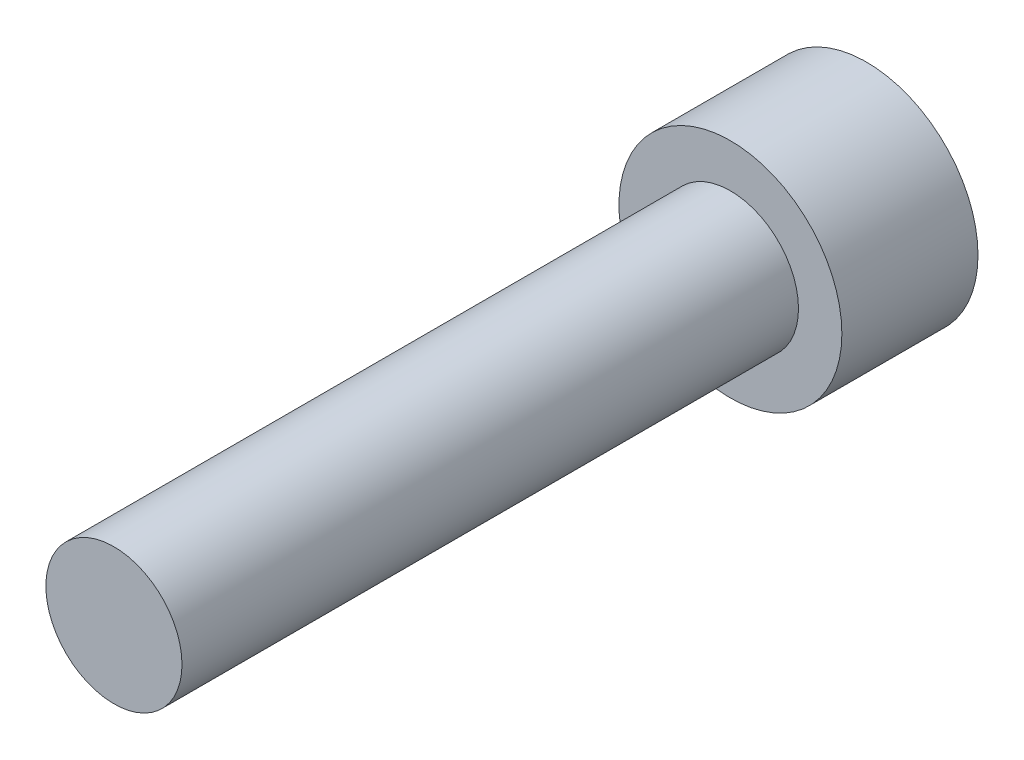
SolidWorks part; units mm, degrees
ref_plane "Front Plane" through (0, 0, 0) normal (0, 0, 1) x (1, 0, 0)
ref_plane "Top Plane" through (0, 0, 0) normal (0, 1, 0) x (1, 0, 0)
ref_plane "Right Plane" through (0, 0, 0) normal (1, 0, 0) x (0, 0, -1)
sketch "Sketch6" plane through (0, 0, 0) normal (1, 0, 0) x (0, 0, -1)
  line L0 (-15.875, 0) -> (22.525, 0) construction
  line L1 (3.1572, 0) -> (-3.1572, 0) construction
  line L2 (-15.875, 0) -> (-15.875, -1.7526)
  line L3 (-15.875, -1.7526) -> (0, -1.7526)
  line L4 (0, 3.1572) -> (0, -3.1572) construction
  line L5 (0, -1.7526) -> (0, -2.8702)
  line L6 (0, -2.8702) -> (3.5052, -2.8702)
  line L7 (3.5052, -2.8702) -> (3.5052, 0)
  line L8 (3.5052, 0) -> (-15.875, 0)
  dimension "L" = 15.875
  dimension "H" = 3.5052
  dimension "A" = 5.7404
  dimension "D" = 3.5052
revolve "Revolve1" add sketch "Sketch6" angle 360 about L0
sketch "Sketch7" plane through (0, 0, -3.5052) normal (0, 0, -1) x (-1, 0, 0)
  line L2 (-1.3843, 0.7992) -> (-1.3843, -0.7992)
  line L4 (-1.3843, -0.7992) -> (0, -1.5985)
  line L5 (0, -1.5985) -> (1.3843, -0.7992)
  line L6 (1.3843, -0.7992) -> (1.3843, 0.7992)
  line L7 (1.3843, 0.7992) -> (0, 1.5985)
  line L8 (0, 1.5985) -> (-1.3843, 0.7992)
  circle A0 centre (0, 0) radius 1.3843 construction
  dimension "J" = 2.7686
extrude "HEX" cut sketch "Sketch7" against normal blind 2.032
